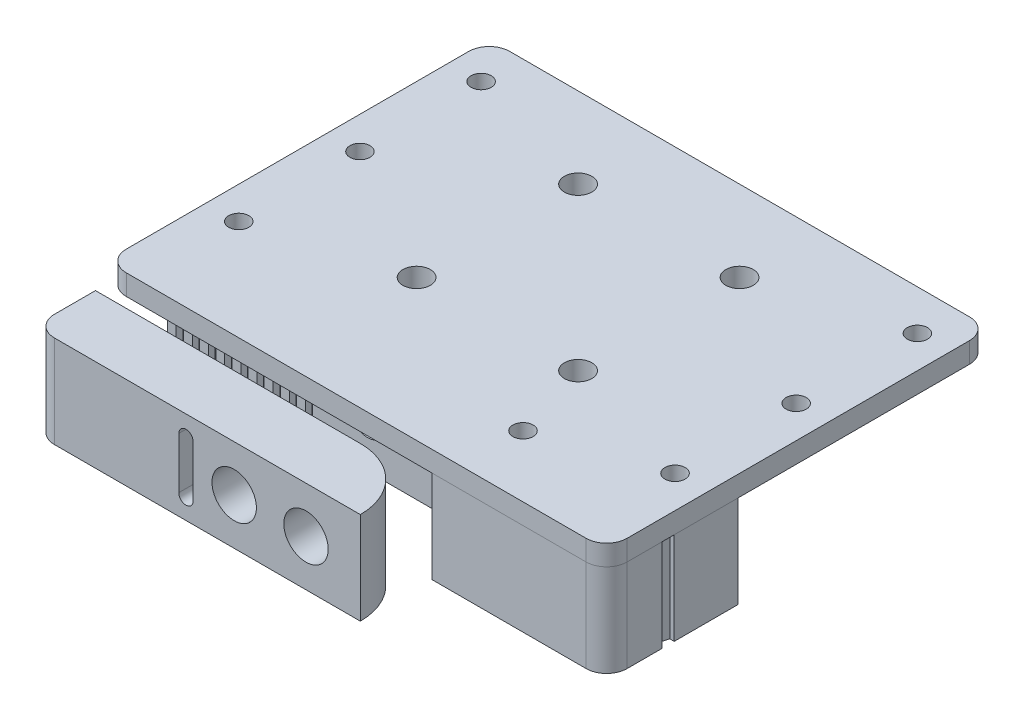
SolidWorks part; units mm, degrees
ref_plane "Front Plane" through (0, 0, 0) normal (0, 0, 1) x (1, 0, 0)
ref_plane "Top Plane" through (0, 0, 0) normal (0, 1, 0) x (1, 0, 0)
ref_plane "Right Plane" through (0, 0, 0) normal (1, 0, 0) x (0, 0, -1)
sketch "Sketch1" plane through (0, 0, 0) normal (0, 1, 0) x (1, 0, 0)
  line L0 (-9.9949, 0) -> (9.9949, 0) construction
  line L1 (-9.9949, -9.9949) -> (9.9949, -9.9949) construction
  line L2 (-9.9949, -9.9949) -> (-9.9949, 9.9949) construction
  line L3 (-9.9949, 9.9949) -> (9.9949, 9.9949) construction
  line L4 (9.9949, -9.9949) -> (9.9949, 9.9949) construction
  line L5 (-9.9949, -9.9949) -> (9.9949, 9.9949) construction
  line L6 (-9.9949, 9.9949) -> (9.9949, -9.9949) construction
  line L7 (-31, 0) -> (31, 0) construction
  line L8 (-28.46, -20) -> (28.46, -20) construction
  line L9 (-31, -17.46) -> (-31, 17.46)
  line L10 (-28.46, 20) -> (28.46, 20)
  line L11 (31, -17.46) -> (31, 17.46)
  line L12 (-27, 20) -> (-27, -20) construction
  line L13 (0, 0) -> (0, 20) construction
  line L14 (-22.9997, -14.7701) -> (22.9997, -14.7701) construction
  line L15 (-22.9997, -13.5001) -> (22.9997, -13.5001) construction
  line L16 (-22.9997, -13.5001) -> (-22.9997, 13.5001) construction
  line L17 (-22.9997, 13.5001) -> (22.9997, 13.5001) construction
  line L18 (22.9997, -13.5001) -> (22.9997, 13.5001) construction
  line L19 (-22.9997, -13.5001) -> (22.9997, 13.5001) construction
  line L20 (-22.9997, 13.5001) -> (22.9997, -13.5001) construction
  line L21 (-22.9997, -14.7701) -> (-31, -14.7701) construction
  line L22 (22.9997, -14.7701) -> (31, -14.7701) construction
  line L23 (-31, -17.46) -> (-31, -24.9301)
  line L24 (-28.46, -27.4701) -> (28.46, -27.4701)
  line L25 (31, -24.9301) -> (31, -17.46)
  circle A0 centre (-9.9949, 9.9949) radius 1.7
  circle A1 centre (9.9949, 9.9949) radius 1.7
  circle A2 centre (9.9949, -9.9949) radius 1.7
  circle A3 centre (-9.9949, -9.9949) radius 1.7
  circle A5 centre (-27, 0) radius 1.25
  circle A6 centre (-27, -15) radius 1.25
  circle A7 centre (-27, 15) radius 1.25
  circle A8 centre (27, 15) radius 1.25
  circle A9 centre (27, 0) radius 1.25
  circle A10 centre (27, -15) radius 1.25
  arc A11 (28.46, 20) -> (31, 17.46) centre (28.46, 17.46) cw
  arc A12 (28.46, -20) -> (31, -17.46) centre (28.46, -17.46) ccw construction
  arc A13 (-28.46, -20) -> (-31, -17.46) centre (-28.46, -17.46) cw construction
  arc A14 (-31, 17.46) -> (-28.46, 20) centre (-28.46, 17.46) cw
  arc A15 (28.46, -27.4701) -> (31, -24.9301) centre (28.46, -24.9301) ccw
  arc A16 (-31, -24.9301) -> (-28.46, -27.4701) centre (-28.46, -24.9301) ccw
  point P0 (0, 0)
  point P18 (0, 0)
  point P39 (31, -20)
  point P42 (-31, -20)
  dimension "D2" = 3.4
  dimension "D3" = 4
  dimension "D7" = 2.5
  dimension "D8" = 2.54
  dimension "D12" = 2.54
  dimension "D1" = 19.9898
  dimension "D4" = 5
  dimension "D5" = 15
  dimension "D6" = 62
  dimension "D9" = 27.0002
  dimension "D10" = 45.9994
  dimension "D13" = 12.7
  dimension "D11" = 1.27
extrude "Boss-Extrude1" add sketch "Sketch1" along normal blind 2.54
sketch "Sketch2" plane through (0, 0, 0) normal (0, -1, 0) x (1, 0, 0)
  line L0 (-31, 14.7701) -> (-28.2287, 14.7701) construction
  line L1 (31, 24.9301) -> (31, -17.46) construction
  line L2 (-31, -17.46) -> (-31, 24.9301) construction
  line L3 (-31, 19.8501) -> (31, 19.8501) construction
  line L4 (31, 19.8501) -> (23.38, 19.8501) construction
  line L7 (31, -17.46) -> (31, 24.9301)
  line L8 (28.46, 27.4701) -> (-28.46, 27.4701)
  line L9 (-31, 24.9301) -> (-31, -17.46)
  line L10 (-28.46, -20) -> (28.46, -20)
  line L12 (28.46, 27.4701) -> (9.41, 27.4701)
  line L13 (-31, 19.8501) -> (-31, 14.7701)
  line L15 (-31, 19.8501) -> (1.79, 19.8501) construction
  line L16 (31, 20.6001) -> (23.38, 20.6001)
  line L17 (9.41, 27.4701) -> (9.41, 19.8501) construction
  line L18 (-1.21, 19.8501) -> (-1.21, 27.4701) construction
  line L19 (-31, 19.8501) -> (-31, 24.9301) construction
  line L20 (-28.46, 27.4701) -> (9.41, 27.4701) construction
  line L21 (-28.46, 27.4701) -> (28.46, 27.4701) construction
  line L27 (31, 19.1001) -> (30.45, 19.1001)
  line L28 (29.55, 19.1001) -> (29.75, 19.8501)
  line L38 (29.75, 19.8501) -> (30.25, 19.8501)
  line L39 (30.25, 19.8501) -> (30.45, 19.1001)
  line L40 (30, 19.8501) -> (30, 19.1001) construction
  line L41 (-11.9, 19.8501) -> (-7, 19.8501)
  line L47 (23.38, 20.6001) -> (23.38, 19.1001) construction
  line L48 (29.55, 19.1001) -> (28.45, 19.1001)
  line L50 (31, 19.1001) -> (23.38, 19.1001) construction
  line L51 (-29.9, 19.8501) -> (-29.825, 19.1001)
  line L52 (-29.825, 19.1001) -> (-29.075, 19.1001)
  line L53 (-29.075, 19.1001) -> (-29, 19.8501)
  line L54 (-29.45, 19.1001) -> (-29.45, 19.8501) construction
  line L55 (-29.9, 19.8501) -> (-31, 19.8501)
  line L56 (-27.9, 19.8501) -> (-29, 19.8501)
  line L57 (-27.9, 19.8501) -> (-27.825, 19.1001)
  line L58 (-27.825, 19.1001) -> (-27.075, 19.1001)
  line L59 (-27.075, 19.1001) -> (-27, 19.8501)
  line L60 (-25.9, 19.8501) -> (-27, 19.8501)
  line L61 (-25.9, 19.8501) -> (-25.825, 19.1001)
  line L62 (-25.825, 19.1001) -> (-25.075, 19.1001)
  line L63 (-25.075, 19.1001) -> (-25, 19.8501)
  line L64 (-23.9, 19.8501) -> (-25, 19.8501)
  line L65 (-23.9, 19.8501) -> (-23.825, 19.1001)
  line L66 (-23.825, 19.1001) -> (-23.075, 19.1001)
  line L67 (-23.075, 19.1001) -> (-23, 19.8501)
  line L68 (-21.9, 19.8501) -> (-23, 19.8501)
  line L69 (-21.9, 19.8501) -> (-21.825, 19.1001)
  line L70 (-21.825, 19.1001) -> (-21.075, 19.1001)
  line L71 (-21.075, 19.1001) -> (-21, 19.8501)
  line L72 (-19.9, 19.8501) -> (-21, 19.8501)
  line L73 (-19.9, 19.8501) -> (-19.825, 19.1001)
  line L74 (-19.825, 19.1001) -> (-19.075, 19.1001)
  line L75 (-19.075, 19.1001) -> (-19, 19.8501)
  line L76 (-17.9, 19.8501) -> (-19, 19.8501)
  line L77 (-17.9, 19.8501) -> (-17.825, 19.1001)
  line L78 (-17.825, 19.1001) -> (-17.075, 19.1001)
  line L79 (-17.075, 19.1001) -> (-17, 19.8501)
  line L80 (-15.9, 19.8501) -> (-17, 19.8501)
  line L81 (-15.9, 19.8501) -> (-15.825, 19.1001)
  line L82 (-15.825, 19.1001) -> (-15.075, 19.1001)
  line L83 (-15.075, 19.1001) -> (-15, 19.8501)
  line L84 (-13.9, 19.8501) -> (-15, 19.8501)
  line L85 (-13.9, 19.8501) -> (-13.825, 19.1001)
  line L86 (-13.825, 19.1001) -> (-13.075, 19.1001)
  line L87 (-13.075, 19.1001) -> (-13, 19.8501)
  line L88 (-11.9, 19.8501) -> (-13, 19.8501)
  line L89 (-11.9, 19.8501) -> (-11.825, 19.1001) construction
  line L90 (-11.825, 19.1001) -> (-11.075, 19.1001) construction
  line L91 (-11.075, 19.1001) -> (-11, 19.8501) construction
  line L92 (-9.9, 19.8501) -> (-11, 19.8501) construction
  line L93 (-9.9, 19.8501) -> (-9.825, 19.1001) construction
  line L94 (-9.825, 19.1001) -> (-9.075, 19.1001) construction
  line L95 (-9.075, 19.1001) -> (-9, 19.8501) construction
  line L96 (-7.9, 19.8501) -> (-9, 19.8501) construction
  line L97 (-7.9, 19.8501) -> (-7.825, 19.1001) construction
  line L98 (-7.825, 19.1001) -> (-7.075, 19.1001) construction
  line L99 (-7.075, 19.1001) -> (-7, 19.8501) construction
  line L100 (1.79, 19.8501) -> (-7, 19.8501)
  line L102 (-23.635, 14.7701) -> (25.7713, 14.7701) construction
  line L103 (28.2287, 14.7701) -> (31, 14.7701) construction
  line L104 (-31, 14.7701) -> (-31, 11.19)
  line L105 (23, -13.5) -> (-23, -13.5) construction
  line L106 (23, -13.5) -> (23, 13.5) construction
  line L107 (23, 13.5) -> (-23, 13.5) construction
  line L108 (-23, -13.5) -> (-23, 13.5) construction
  line L109 (23, -13.5) -> (-23, 13.5) construction
  line L110 (23, 13.5) -> (-23, -13.5) construction
  line L111 (-31, 11.19) -> (-23.635, 11.19)
  line L112 (-23.635, 11.19) -> (-23.635, 14.7701)
  line L113 (-23.635, 14.7701) -> (-28.2287, 14.7701) construction
  line L114 (0, 0) -> (0, -20) construction
  line L115 (28.46, -20) -> (-28.46, -20) construction
  line L116 (23.635, 11.19) -> (23.635, 14.7701)
  line L117 (31, 11.19) -> (23.635, 11.19)
  line L118 (31, 14.7701) -> (31, 11.19)
  line L119 (23.635, 14.7701) -> (-23.635, 14.7701)
  line L120 (29.55, 19.1001) -> (30.45, 19.1001) construction
  line L122 (28.25, 19.8501) -> (28.45, 19.1001)
  line L123 (27.75, 19.8501) -> (28.25, 19.8501)
  line L124 (27.55, 19.1001) -> (27.75, 19.8501)
  line L125 (26.25, 19.8501) -> (26.45, 19.1001)
  line L126 (25.75, 19.8501) -> (26.25, 19.8501)
  line L127 (25.55, 19.1001) -> (25.75, 19.8501)
  line L128 (24.25, 19.8501) -> (24.45, 19.1001)
  line L129 (23.75, 19.8501) -> (24.25, 19.8501)
  line L130 (23.55, 19.1001) -> (23.75, 19.8501)
  line L131 (23.55, 19.1001) -> (23.38, 19.1001)
  line L132 (25.55, 19.1001) -> (24.45, 19.1001)
  line L133 (27.55, 19.1001) -> (26.45, 19.1001)
  line L134 (22.1918, 20.0089) -> (22.0117, 19.263) construction
  line L135 (23.55, 19.1001) -> (24.45, 19.1001) construction
  line L136 (24, 19.8501) -> (24, 19.1001) construction
  line L137 (22.1918, 20.0089) -> (23.38, 24.9301) construction
  line L138 (23.38, 24.9301) -> (20.6054, 20.6956) construction
  arc A2 (23.38, 19.8501) -> (18.3, 24.9301) centre (23.38, 24.9301) cw construction
  arc A3 (1.79, 19.8501) -> (9.41, 27.4701) centre (1.79, 27.4701) ccw
  arc A4 (28.46, -20) -> (31, -17.46) centre (28.46, -17.46) ccw
  arc A5 (31, 24.9301) -> (28.46, 27.4701) centre (28.46, 24.9301) ccw
  arc A6 (-28.46, 27.4701) -> (-31, 24.9301) centre (-28.46, 24.9301) ccw
  arc A7 (-31, -17.46) -> (-28.46, -20) centre (-28.46, -17.46) ccw
  arc A9 (31, 24.9301) -> (28.46, 27.4701) centre (28.46, 24.9301) ccw
  arc A12 (-31, 24.9301) -> (-28.46, 27.4701) centre (-28.46, 24.9301) cw construction
  arc A17 (23.38, 20.6001) -> (19.05, 24.9301) centre (23.38, 24.9301) cw
  arc A19 (23.38, 19.1001) -> (17.55, 24.9301) centre (23.38, 24.9301) cw construction
  arc A20 (31, 20.6001) -> (31, 19.1001) centre (31, 19.8501) cw construction
  circle A21 centre (27, 15) radius 1.25 construction
  arc A23 (28.2287, 14.7701) -> (25.7713, 14.7701) centre (27, 15) ccw construction
  circle A24 centre (-27, 15) radius 1.25 construction
  circle A25 centre (-27, 15) radius 1.25
  circle A26 centre (27, 15) radius 1.25
  arc A27 (19.05, 24.9301) -> (17.55, 24.9301) centre (18.3, 24.9301) ccw
  arc A28 (23.38, 19.8501) -> (18.3, 24.9301) centre (23.38, 24.9301) cw construction
  arc A29 (22.0117, 19.263) -> (23.38, 19.1001) centre (23.38, 24.9301) ccw construction
  arc A30 (22.4532, 19.1742) -> (23.38, 19.1001) centre (23.38, 24.9301) ccw
  arc A31 (17.9697, 22.7582) -> (18.4728, 21.7823) centre (23.38, 24.9301) ccw
  arc A32 (19.0158, 21.0645) -> (19.8179, 20.3149) centre (23.38, 24.9301) ccw
  arc A33 (20.5707, 19.8216) -> (21.5783, 19.3855) centre (23.38, 24.9301) ccw
  arc A34 (17.55, 24.9301) -> (17.6999, 23.6168) centre (23.38, 24.9301) ccw
  arc A35 (20.5707, 19.8216) -> (21.4186, 19.44) centre (23.38, 24.9301) ccw
  arc A36 (19.0158, 21.0645) -> (19.6858, 20.4199) centre (23.38, 24.9301) ccw
  arc A37 (17.9697, 22.7582) -> (18.3838, 21.9257) centre (23.38, 24.9301) ccw
  point P95 (0, 0)
  point P163 (23.38, 24.9301)
  line B0 (22.4348, 19.9502) -> (22.4532, 19.1742)
  line B1 (21.9488, 20.0676) -> (22.4348, 19.9502)
  line B2 (21.5783, 19.3855) -> (21.9488, 20.0676)
  line B3 (20.8145, 20.5585) -> (20.5707, 19.8216)
  line B4 (20.3963, 20.8326) -> (20.8145, 20.5585)
  line B5 (19.8179, 20.3149) -> (20.3963, 20.8326)
  line B6 (19.4933, 21.6765) -> (19.0158, 21.0645)
  line B7 (19.1916, 22.0753) -> (19.4933, 21.6765)
  line B8 (18.4728, 21.7823) -> (19.1916, 22.0753)
  line B9 (18.6252, 23.1738) -> (17.9697, 22.7582)
  line B10 (18.4753, 23.6508) -> (18.6252, 23.1738)
  line B11 (17.6999, 23.6168) -> (18.4753, 23.6508)
  dimension "D7" = 2.54
  dimension "D14" = 19.66
  dimension "D2" = 14.7701
  dimension "D3" = 5.08
  dimension "D4" = 1.5
  dimension "D5" = 2
  dimension "D6" = 3
  dimension "D8" = 7.62
  dimension "D11" = 0.5
  dimension "D12" = 4
  dimension "D13" = 1.995
  dimension "D15" = 4
  dimension "D16" = 0.75
  dimension "D17" = 0.9
  dimension "D18" = 46
  dimension "D19" = 0.75
  dimension "D21" = 2
  dimension "D22" = 27
  dimension "D23" = 0.635
  dimension "D24" = 3.81
  dimension "D9" = 1
  dimension "D10" = 0.9
  dimension "D1" = 0
  dimension "D20" = 12
sketch_block_instance "Block1-1"
sketch_block "Block1"
sketch_block_instance "Block1-2"
sketch_block_instance "Block1-3"
sketch_block_instance "Block1-4"
extrude "Boss-Extrude2" add sketch "Sketch2" along normal blind 11.43 separate body contours B11 A34 A27 A17 L16 A3 L100 L99 L98 L97 L96 L95 L94 L93 L92 L91 L90 L89 L88 L87 L86 L85 L84 L83 L82 L81 L80 L79 L78 L77 L76 L75 L74 L73 L72 L71 L70 L69 L68 L67 L66 L65 L64 L63 L62 L61 L60 L59 M66 M67 M68
sketch "Sketch3" plane through (0, 0, 0) normal (0, -1, 0) x (-1, 0, 0)
  line L0 (31, 17.46) -> (31, -24.9301) construction
  line L1 (28.46, -27.4701) -> (-28.46, -27.4701) construction
  line L2 (-1.79, -19.8501) -> (7, -19.8501) construction
  line L3 (31, -19.8501) -> (31, -24.9301) construction
  line L4 (28.46, -27.4701) -> (-9.41, -27.4701) construction
  line L5 (-1.79, -19.8501) -> (7, -19.8501) construction
  line L6 (7, -19.8501) -> (31, -19.8501) construction
  line L7 (28.46, -36.3601) -> (-9.41, -36.3601)
  line L8 (-1.79, -28.7401) -> (7, -28.7401)
  line L9 (7, -28.7401) -> (31, -28.7401)
  line L10 (31, -28.7401) -> (31, -33.8201)
  arc A0 (28.46, -27.4701) -> (31, -24.9301) centre (28.46, -24.9301) ccw construction
  arc A1 (-1.79, -19.8501) -> (-9.41, -27.4701) centre (-1.79, -27.4701) ccw construction
  arc A2 (28.46, -27.4701) -> (31, -24.9301) centre (28.46, -24.9301) ccw construction
  arc A3 (-1.79, -19.8501) -> (-9.41, -27.4701) centre (-1.79, -27.4701) ccw construction
  arc A4 (-1.79, -28.7401) -> (-9.41, -36.3601) centre (-1.79, -36.3601) ccw
  arc A5 (28.46, -36.3601) -> (31, -33.8201) centre (28.46, -33.8201) ccw
  dimension "D2" = 8.89
  dimension "D1" = 2
extrude "Boss-Extrude3" add sketch "Sketch3" along normal blind 11.43 separate body
sketch "Sketch4" plane through (0, 0, 36.3601) normal (0, 0, 1) x (1, 0, 0)
  line L0 (-12.18, -2.54) -> (-12.18, -8.89) construction
  line L1 (-11.291, -2.54) -> (-11.291, -8.89)
  line L2 (-13.069, -2.54) -> (-13.069, -8.89)
  line L3 (-28.46, -5.715) -> (9.41, -5.715) construction
  line L4 (-28.46, -11.43) -> (-28.46, 0) construction
  line L5 (9.41, -11.43) -> (9.41, 0) construction
  arc A0 (-11.291, -2.54) -> (-13.069, -2.54) centre (-12.18, -2.54) ccw
  arc A1 (-13.069, -8.89) -> (-11.291, -8.89) centre (-12.18, -8.89) ccw
  point P2 (-12.18, -5.715)
  point P13 (-8.37, -5.715)
  dimension "D1" = 21.59
  dimension "D2" = 6.35
  dimension "D3" = 1.778
extrude "Cut-Extrude1" cut sketch "Sketch4" against normal up to next (7.62 mm away)
hole_wizard "Ø5.5 (5.5) Diameter Hole1" positions "Sketch5" profile "Sketch6" hole size "Ø5.5" standard "ANSI Metric"
sketch "Sketch5" plane through (0, 0, 36.3601) normal (0, 0, 1) x (1, 0, 0)
  line L0 (-11.291, -5.715) -> (9.41, -5.715) construction
  line L1 (-11.291, -8.89) -> (-11.291, -2.54) construction
  line L2 (9.41, -11.43) -> (9.41, 0) construction
  point P0 (-6.211, -5.715)
  point P12 (2.679, -5.715)
  point P15 (1.5035, -5.715)
  dimension "D1" = 5.08
  dimension "D2" = 8.89
sketch "Sketch6" plane through (-6.211, -5.715, 36.3601) normal (1, 0, 0) x (0, -1, 0)
  line L0 (0, 0) -> (0, 9.2724)
  line L1 (0, 9.2724) -> (2.75, 7.62)
  line L2 (2.75, 7.62) -> (2.75, 0)
  line L5 (2.75, 0) -> (0, 0)
  line L10 (0, 9.2724) -> (-2.75, 7.62) construction
  line L11 (0, -6.35) -> (0, 107.95) construction
  dimension "Hole Dia." = 5.5
  dimension "Hole Depth" = 7.62
  dimension "Drill Angle" = 118
hole_wizard "Ø4.2 (4.2) Diameter Hole1" positions "Sketch7" profile "Sketch8" hole size "Ø4.2" standard "ANSI Metric"
sketch "Sketch7" plane through (0, 0, 19.8501) normal (0, 0, 1) x (1, 0, 0)
  circle A0 centre (-6.211, -5.715) radius 2.75 construction
  circle A1 centre (2.679, -5.715) radius 2.75 construction
  point P0 (-6.211, -5.715)
  point P8 (2.679, -5.715)
  point P13 (0, 0)
sketch "Sketch8" plane through (-6.211, -5.715, 19.8501) normal (1, 0, 0) x (0, -1, 0)
  line L0 (0, 0) -> (0, 39.8501)
  line L1 (0, 39.8501) -> (2.1, 39.8501)
  line L2 (2.1, 39.8501) -> (2.1, 0)
  line L5 (2.1, 0) -> (0, 0)
  line L11 (0, -6.35) -> (0, 107.95) construction
  dimension "Thru Hole Dia." = 4.2
  dimension "Thru Hole Depth" = 39.8501
hole_wizard "Ø2.5 (2.5) Diameter Hole1" positions "Sketch9" profile "Sketch10" hole size "Ø2.5" standard "ANSI Metric"
sketch "Sketch9" plane through (0, -11.43, 0) normal (0, -1, 0) x (-1, 0, 0)
  line L0 (-13.0319, -14.7701) -> (-13.0319, -27.4701) construction
  line L1 (-23.635, -14.7701) -> (23.635, -14.7701) construction
  line L2 (-28.46, -27.4701) -> (-9.41, -27.4701) construction
  line L5 (-17.6999, -23.6168) -> (-8.3639, -23.6168) construction
  arc A0 (-1.79, -19.8501) -> (-9.41, -27.4701) centre (-1.79, -27.4701) ccw construction
  point P0 (-13.0319, -19.8501)
  point P32 (-13.0319, -23.6168)
  dimension "D1" = 5.08
sketch "Sketch10" plane through (13.0319, -11.43, 19.8501) normal (1, 0, 0) x (0, 0, -1)
  line L0 (0, 0) -> (0, 13.97)
  line L1 (0, 13.97) -> (1.25, 13.97)
  line L2 (1.25, 13.97) -> (1.25, 0)
  line L5 (1.25, 0) -> (0, 0)
  line L11 (0, -6.35) -> (0, 107.95) construction
  dimension "Thru Hole Dia." = 2.5
  dimension "Thru Hole Depth" = 13.97
